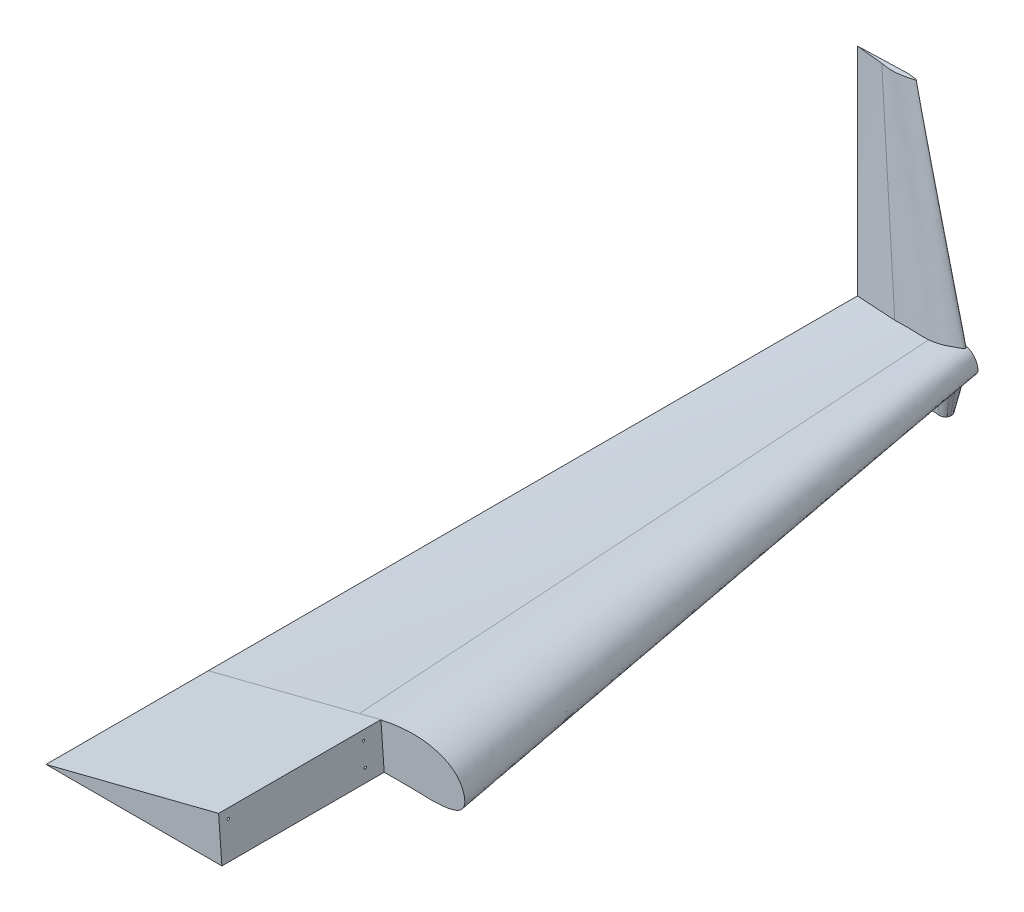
SolidWorks part; units mm, degrees
other "<Wing>-<Cut-Extrude1>"
ref_plane "X Y" through (0, 0, 0) normal (0, 0, 1) x (1, 0, 0)
ref_plane "X Z" through (0, 0, 0) normal (0, 1, 0) x (1, 0, 0)
ref_plane "Y Z" through (0, 0, 0) normal (1, 0, 0) x (0, 0, -1)
mirrored part "Wing-"
